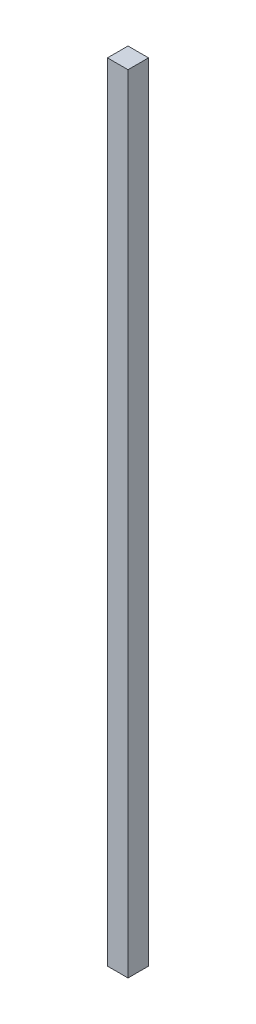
SolidWorks part; units mm, degrees
ref_plane "前视基准面" through (0, 0, 0) normal (0, 0, 1) x (1, 0, 0)
ref_plane "上视基准面" through (0, 0, 0) normal (0, 1, 0) x (1, 0, 0)
ref_plane "右视基准面" through (0, 0, 0) normal (1, 0, 0) x (0, 0, -1)
other "Configuration Table"
sketch "草图1" plane through (0, 0, 0) normal (0, 1, 0) x (1, 0, 0)
  line L1 (-30, 30) -> (30, 30)
  line L2 (-30, 30) -> (-30, -30)
  line L3 (-30, -30) -> (30, -30)
  line L4 (30, 30) -> (30, -30)
  line L5 (-30, 30) -> (30, -30) construction
  line L6 (-30, -30) -> (30, 30) construction
  point P0 (0, 0)
extrude "凸台-拉伸1" add sketch "草图1" along normal blind 2300
sketch "草图2" plane through (0, 0, 30) normal (0, 0, 1) x (1, 0, 0)
  line L0 (-30, 1800) -> (30, 1800)
  line L1 (-30, 2300) -> (-30, 0) construction
  line L2 (30, 2300) -> (30, 0) construction
  line L3 (-30, 2290) -> (30, 2290)
  line L4 (-30, 2300) -> (30, 2300) construction
  line L5 (-30, 490) -> (30, 490)
  line L6 (-30, 0) -> (30, 0) construction
  dimension "D1" = 1800
  dimension "D2" = 10
  dimension "D3" = 490
sketch "草图3" plane through (30, 0, 0) normal (1, 0, 0) x (0, 0, -1)
  line L0 (-30, 490) -> (30, 490)
  line L1 (-30, 2300) -> (-30, 0) construction
  line L2 (30, 2300) -> (30, 0) construction
  line L3 (-30, 1800) -> (30, 1800)
  line L4 (-30, 2290) -> (30, 2290)
  line L5 (-30, 2300) -> (30, 2300) construction
  line L6 (-30, 0) -> (30, 0) construction
  dimension "D1" = 10
  dimension "D2" = 490
  dimension "D3" = 1800
